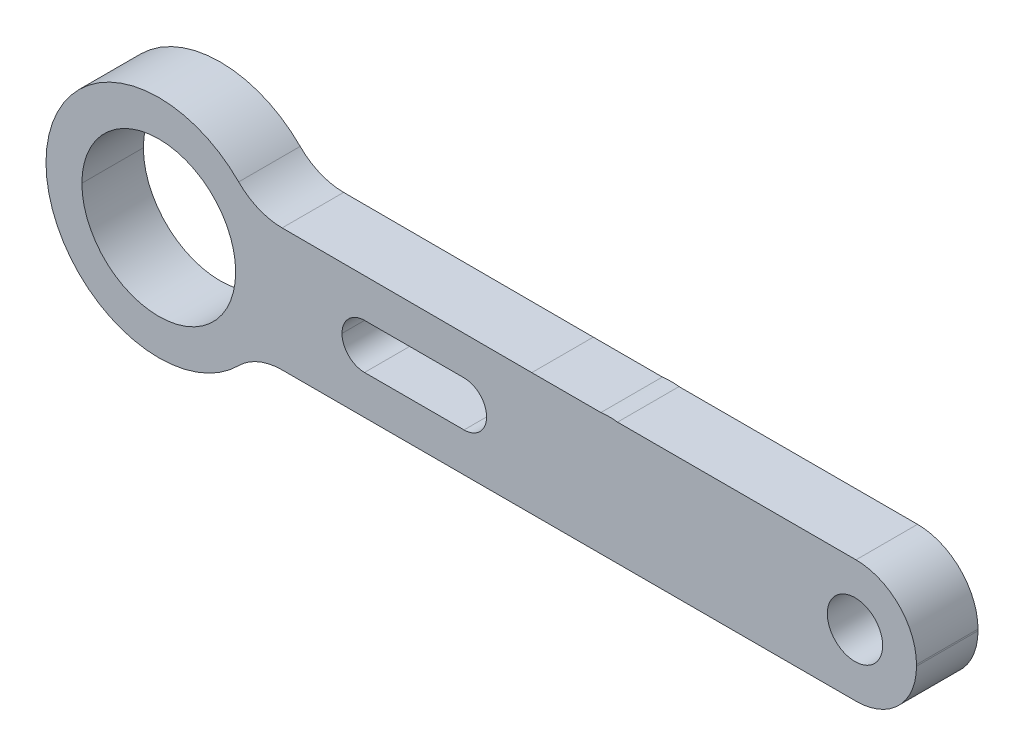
SolidWorks part; units mm, degrees
ref_plane "Front Plane" through (0, 0, 0) normal (0, 0, 1) x (1, 0, 0)
ref_plane "Top Plane" through (0, 0, 0) normal (0, 1, 0) x (1, 0, 0)
ref_plane "Right Plane" through (0, 0, 0) normal (1, 0, 0) x (0, 0, -1)
imported_body "Imported1"
sketch "Sketch1" plane through (0, 0, 3) normal (0, 0, 1) x (1, 0, 0)
  line L0 (-4.4396, 24.432) -> (-19.9406, 24.4633) construction
  line L1 (-7.7637, 24.4387) -> (8.05, 24.4387)
  line L2 (-7.7637, 24.4387) -> (-7.7637, 18.4662)
  line L3 (-7.7637, 18.4662) -> (8.05, 18.4662)
  line L4 (11, 21.4887) -> (11, 21.4162)
  arc A0 (11, 21.4887) -> (8.05, 24.4387) centre (8.05, 21.4887) ccw
  arc A1 (11, 21.4162) -> (8.05, 18.4662) centre (8.05, 21.4162) cw
  dimension "D1" = 2.95
sketch "Sketch2" plane through (0, 0, 3) normal (0, 0, 1) x (1, 0, 0)
  circle A0 centre (8, 21.4662) radius 1.35
extrude "Extrude1" add sketch "Sketch1" against normal blind 3
extrude "Cut-Extrude1" cut sketch "Sketch2" against normal blind 3
